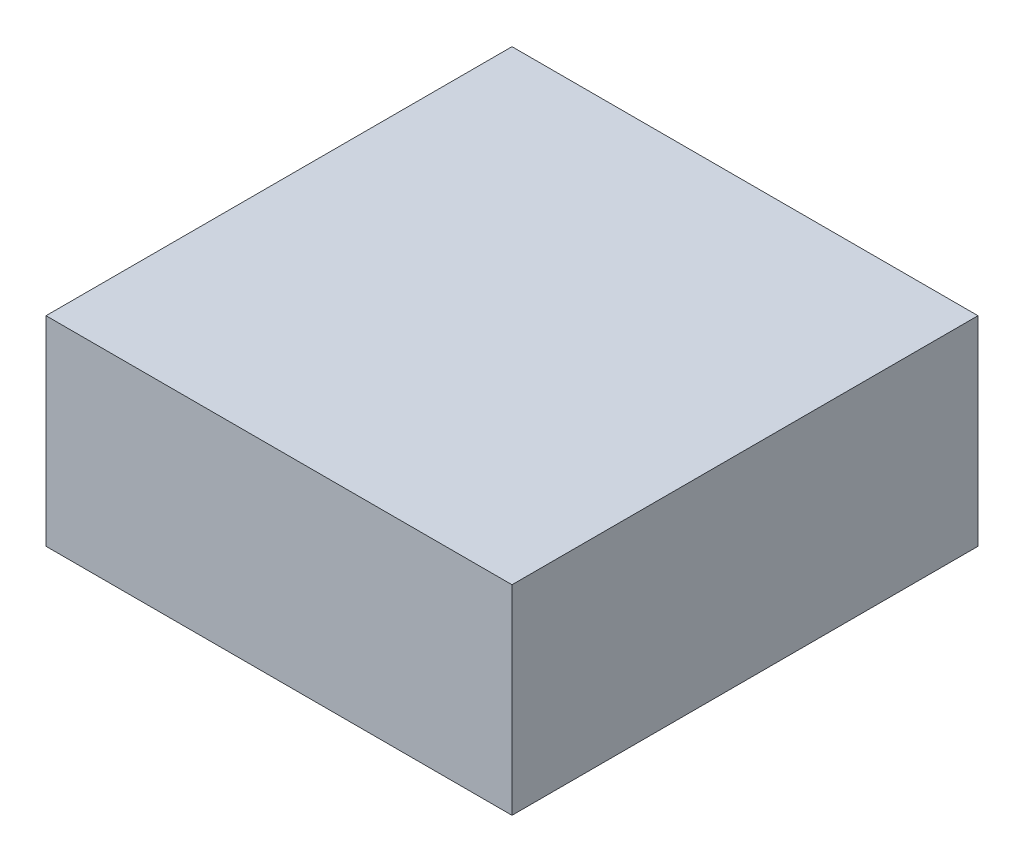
SolidWorks part; units mm, degrees
ref_plane "Front Plane" through (0, 0, 0) normal (0, 0, 1) x (1, 0, 0)
ref_plane "Top Plane" through (0, 0, 0) normal (0, 1, 0) x (1, 0, 0)
ref_plane "Right Plane" through (0, 0, 0) normal (1, 0, 0) x (0, 0, -1)
sketch "Sketch1" plane through (0, 0, 0) normal (1, 0, 0) x (0, 0, -1)
  line L0 (0, 0) -> (0, 11.8952) construction
  line L1 (0, 4) -> (7.5, 4)
  line L2 (7.5, 4) -> (10.5, 0)
  line L3 (10.5, 0) -> (13, 0)
  line L4 (13, 0) -> (8.5, 6)
  line L5 (8.5, 6) -> (0, 6)
  line L8 (0, 6) -> (0, 4)
  dimension "D1" = 13
  dimension "D2" = 6
  dimension "D4" = 2
  dimension "D5" = 2
  dimension "D6" = 8.5
revolve "Revolve1" add sketch "Sketch1" angle 360 about L0
sketch "Sketch2" plane through (0, 6, 0) normal (0, 1, 0) x (1, 0, 0)
  line L0 (0, 6.8) -> (-2.25, 3.8162)
  line L1 (-2.25, 3.8162) -> (0, 1.6)
  line L2 (0, 1.6) -> (2.25, 3.8162)
  line L3 (2.25, 3.8162) -> (0, 6.8)
  line L4 (0, 0) -> (0, 6.8) construction
  dimension "D1" = 4.5
  dimension "D2" = 5.2
  dimension "D3" = 6.8
  dimension "D4" = 2.2162
  dimension "D5" = 3.7371
extrude "Boss-Extrude1" add sketch "Sketch2" along normal blind 1 draft 20
pattern_circular "CirPattern1" count 3 over 360 about axis through (0, 0, 0) along (0, 1, 0) of "Boss-Extrude1"
fillet "Fillet1" radius 2 1 edges at (0, 6, -8.5)
fillet "Fillet2" radius 0.5 24 edges at (-2.3159, 6.5, 3.6565) (-1.6069, 6.5, 0.9277) (-4.3246, 6.5, 0.1774) (-5.6272, 6.5, 3.2489) (4.3246, 6.5, 0.1774) (1.6069, 6.5, 0.9277) (2.3159, 6.5, 3.6565) (5.6272, 6.5, 3.2489) (-2.0087, 6.5, -3.8339) (0, 6.5, -1.8554) (0, 6.5, -6.4977) (2.0087, 6.5, -3.8339) (-1.7828, 6, 2.3283) (-2.9078, 6, 0.3798) (-5.1594, 6, 1.6798) (-4.0344, 6, 3.6283) (2.9078, 6, 0.3798) (1.7828, 6, 2.3283) (4.0344, 6, 3.6283) (-1.125, 6, -2.7081) (1.125, 6, -2.7081) (1.125, 6, -5.3081) (-1.125, 6, -5.3081) (5.1594, 6, 1.6798)
sketch "Sketch3" plane through (0, 0, 0) normal (1, 0, 0) x (0, 0, -1)
  line L1 (7.5, 6) -> (-7.5, 6) construction
  line L3 (0, 0) -> (0, 6.7) construction
  line L9 (7.5, 6) -> (0, 6)
  line L12 (13, 0) -> (9.1, 5.2) construction
  line L14 (0, 6.7) -> (0, 6)
  line L15 (13, 0) -> (9.1, 5.2)
  line L16 (14.875, 0) -> (10.45, 5.9)
  line L17 (8.85, 6.7) -> (0, 6.7)
  line L18 (13, 0) -> (14.875, 0)
  line L19 (14.2, 0.9) -> (9.85, 6.7) construction
  line L20 (9.85, 6.7) -> (0, 6.7) construction
  line L21 (9.1, 5.2) -> (0, 5.2) construction
  arc A0 (10.45, 5.9) -> (8.85, 6.7) centre (8.85, 4.7) ccw
  arc A1 (9.1, 5.2) -> (7.5, 6) centre (7.5, 4) ccw construction
  arc A2 (9.1, 5.2) -> (7.5, 6) centre (7.5, 4) ccw
  dimension "D2" = 2
  dimension "D1" = 1.5
revolve "Revolve2" add sketch "Sketch3" angle 360 about L3
combine bodies "Combine1" operation type add bodies to combine 103 105
sketch "Sketch4" plane through (0, 0, 0) normal (0, 1, 0) x (1, 0, 0)
  line L1 (-17.5, -17.5) -> (17.5, -17.5)
  line L2 (-17.5, -17.5) -> (-17.5, 17.5)
  line L3 (-17.5, 17.5) -> (17.5, 17.5)
  line L4 (17.5, -17.5) -> (17.5, 17.5)
  line L5 (-17.5, -17.5) -> (17.5, 17.5) construction
  line L6 (-17.5, 17.5) -> (17.5, -17.5) construction
  point P0 (0, 0)
  dimension "D1" = 35
extrude "Boss-Extrude2" add sketch "Sketch4" along normal blind 15 separate body
combine bodies "Combine2" operation type subtract main body 107 bodies to subtract 106
